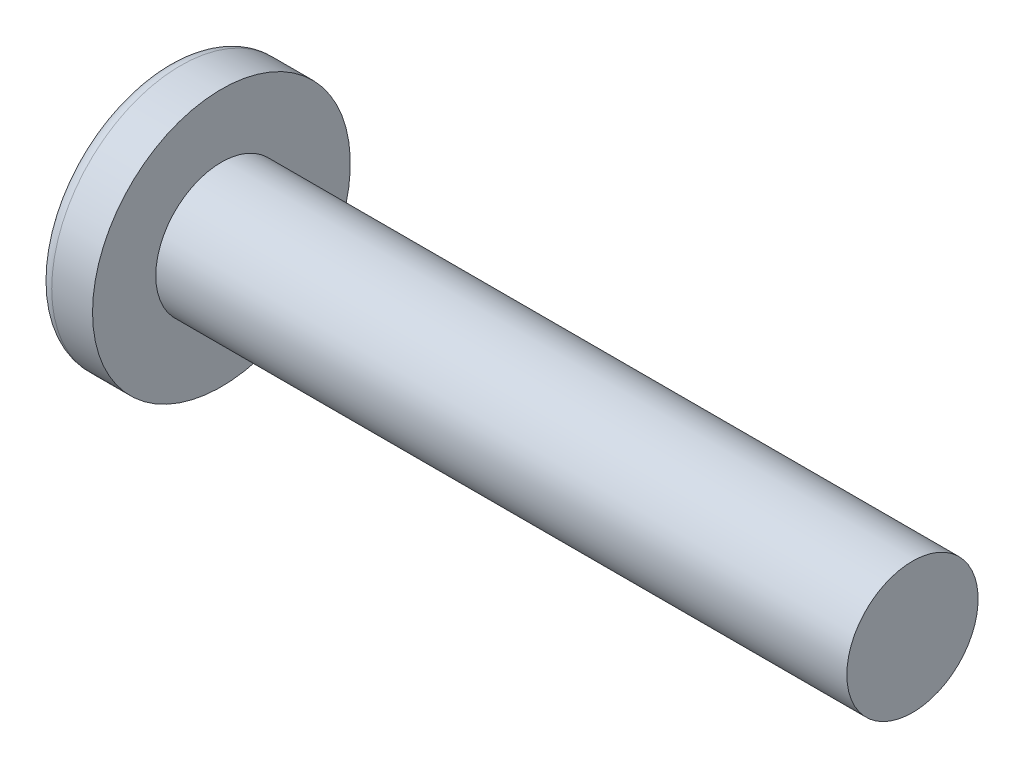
SolidWorks part; units mm, degrees
ref_plane "Plane1" through (0, 0, 0) normal (0, 0, 1) x (1, 0, 0)
ref_plane "Plane2" through (0, 0, 0) normal (0, 1, 0) x (1, 0, 0)
ref_plane "Plane3" through (0, 0, 0) normal (1, 0, 0) x (0, 0, -1)
sketch "BodySke" plane through (0, 0, 0) normal (0, 0, 1) x (1, 0, 0)
  line L0 (3.3782, 2.413) -> (3.3782, 4.7371)
  line L1 (3.9078, 6.35) -> (3.9078, -3.175) construction
  line L2 (-25.4, 0) -> (127, 0) construction
  line L3 (28.7782, 0) -> (0, 0)
  line L4 (3.3782, 2.413) -> (28.7782, 2.413)
  line L5 (28.7782, 2.413) -> (28.7782, 0)
  line L6 (1.8777, 4.7371) -> (3.3782, 4.7371)
  line L7 (3.3782, -2.413) -> (28.7782, -2.413) construction
  line L8 (3.3782, 6.35) -> (3.3782, -3.175) construction
  arc A0 (1.4662, 4.5269) -> (0, 0) centre (7.7216, 0) ccw
  arc A2 (1.4662, 4.5269) -> (1.8777, 4.7371) centre (1.8777, 4.2291) cw
  dimension "Head_fillet_rad" = 0.508
  dimension "Head_crown_rad" = 7.7216
  dimension "Head_ht" = 3.3782
  dimension "Diameter" = 4.826
  dimension "Length" = 25.4
  dimension "Head_dia" = 9.4742
  dimension "Advance" = 1.0592
  dimension "Thread_nom" = 25.4
revolve "Base-Revolve" add sketch "BodySke" angle 360 about L2
sketch "Sketch3" plane through (0, 0, 0) normal (1, 0, 0) x (0, 0, -1)
  line L0 (0.5842, -3.048) -> (-0.5842, -3.048)
  line L1 (0.5842, -3.048) -> (0.5842, 3.048)
  line L2 (-0.5842, 3.048) -> (0.5842, 3.048)
  line L3 (-0.5842, 3.048) -> (-0.5842, -3.048)
  dimension "D1" = 3.048
  dimension "Cross_dia" = 6.096
  dimension "D2" = 0.5842
  dimension "Cross_width" = 1.1684
ref_plane "Plane4" through (3.4798, 0, 0) normal (1, 0, 0) x (0, 0, -1)
sketch "Sketch4" plane through (3.4798, 0, 0) normal (1, 0, 0) x (0, 0, -1)
  line L0 (0.2921, -0.2921) -> (-0.2921, -0.2921)
  line L1 (0.2921, -0.2921) -> (0.2921, 0.2921)
  line L2 (-0.2921, 0.2921) -> (0.2921, 0.2921)
  line L3 (-0.2921, 0.2921) -> (-0.2921, -0.2921)
  dimension "D1" = 0.5842
  dimension "D2" = 0.5842
  dimension "D3" = 0.2921
  dimension "D4" = 0.2921
loft "Cut-Loft1" cut profiles "Sketch3", "Sketch4"
pattern_circular "CirPattern1" count 2 every 90 about axis through (0, 0, 0) along (1, 0, 0) of "Cut-Loft1"
sketch "ThdSchSke" plane through (0, 0, 0) normal (0, 0, 1) x (1, 0, 0)
  line L0 (4.4374, -1.7831) -> (3.9963, -2.413)
  line L1 (4.4374, -1.7831) -> (4.8785, -2.413)
  line L2 (4.8785, -2.413) -> (4.8785, -3.0162)
  line L3 (-3.175, 0) -> (5.1513, 0) construction
  line L5 (4.8785, -3.0162) -> (3.9963, -3.0162)
  line L6 (3.9963, -3.0162) -> (3.9963, -2.413)
  dimension "Thread_minor" = 3.5662
  dimension "Diameter" = 4.826
  dimension "Start" = 4.4374
  dimension "SideAngle" = 55
  dimension "VeeAngle" = 70
  dimension "Overcut" = 6.0325
revolve "ThreadSchematic" [suppressed] cut sketch "ThdSchSke" angle 360 about L3
pattern_linear "ThdSchPat" [suppressed]
equation "\"D1@Sketch3\" = \"Cross_dia@Sketch3\" / 2"
equation "\"D2@Sketch3\" = \"Cross_width@Sketch3\" / 2"
equation "\"D1@Sketch4\" = \"Cross_width@Sketch3\" *.5"
equation "\"D2@Sketch4\" = \"D1@Sketch4\""
equation "\"D3@Sketch4\" = \"D1@Sketch4\" / 2"
equation "\"D4@Sketch4\" = \"D2@Sketch4\" / 2"
equation "\"Thread_length@ThreadCosmetic\" = ((sgn( (\"Length@BodySke\" - \"Advance@BodySke\" ) - \"Thread_nom@BodySke\" )-1)*( (\"Length@BodySke\" - \"Advance@BodySke\" ) - \"Thread_nom@BodySke\" ))/-2+ \"Thread_nom@BodySke\""
equation "\"Thread_minor@ThdSchSke\" = \"Thread_minor@ThreadCosmetic\""
equation "\"Diameter@ThdSchSke\" = \"Diameter@BodySke\""
equation "\"Overcut@ThdSchSke\" = \"Diameter@BodySke\" * 1.25"
equation "\"Start@ThdSchSke\" = \"Head_ht@BodySke\" + \"Length@BodySke\" - \"Thread_length@ThreadCosmetic\"  '---Non-countersunk---"
equation "\"Num_threads@ThdSchPat\" = int( \"Thread_length@ThreadCosmetic\" / \"Advance@BodySke\" + 0.999 )  + 1"
equation "\"Advance@ThdSchPat\" = \"Thread_length@ThreadCosmetic\" /  (\"Num_threads@ThdSchPat\" - 1) 'relax it"
